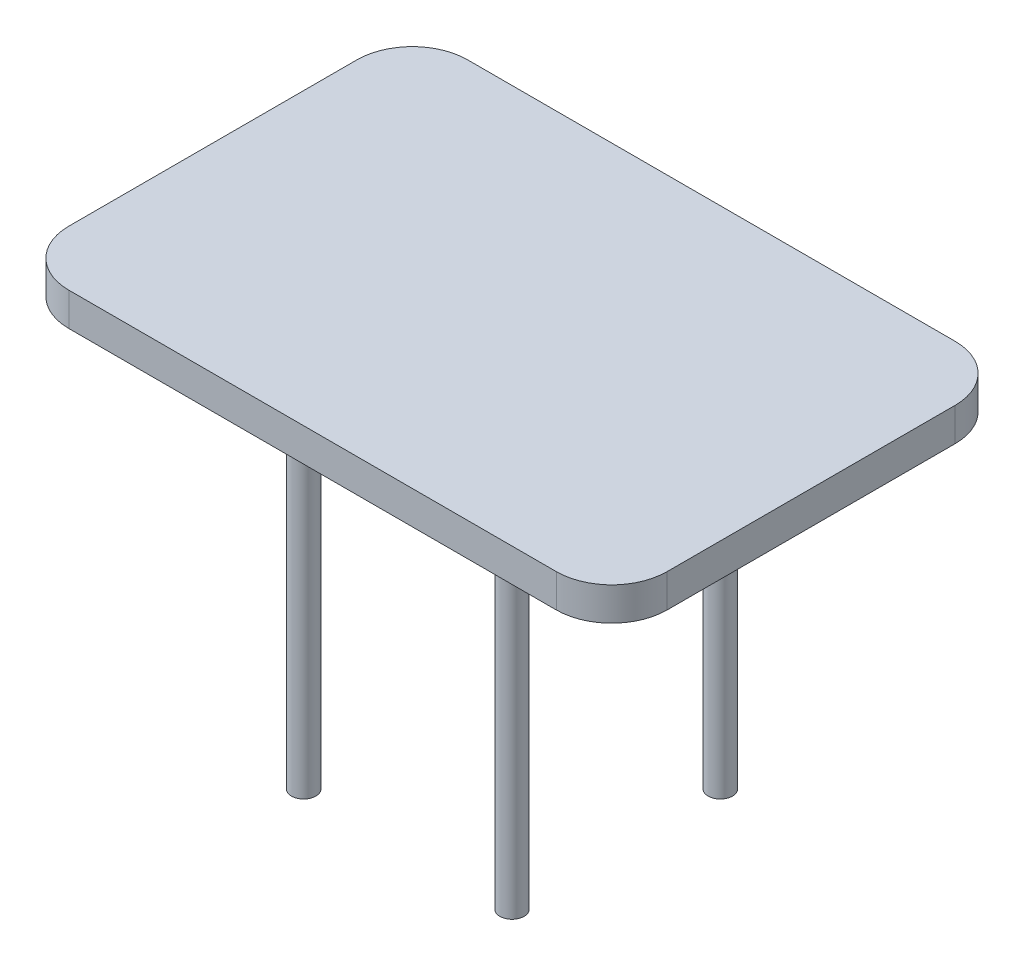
SolidWorks part; units mm, degrees
ref_plane "Front Plane" through (0, 0, 0) normal (0, 0, 1) x (1, 0, 0)
ref_plane "Top Plane" through (0, 0, 0) normal (0, 1, 0) x (1, 0, 0)
ref_plane "Right Plane" through (0, 0, 0) normal (1, 0, 0) x (0, 0, -1)
sketch "Sketch1" plane through (0, 0, 0) normal (0, 1, 0) x (1, 0, 0)
  line L1 (-75, 50) -> (75, 50) construction
  line L2 (-75, 50) -> (-75, -50) construction
  line L3 (-75, -50) -> (75, -50) construction
  line L4 (75, 50) -> (75, -50) construction
  line L5 (-75, 50) -> (75, -50) construction
  line L6 (-75, -50) -> (75, 50) construction
  line L7 (-135, 90) -> (135, 90)
  line L8 (-135, 90) -> (-135, -90)
  line L9 (-135, -90) -> (135, -90)
  line L10 (135, 90) -> (135, -90)
  line L11 (-135, 90) -> (135, -90) construction
  line L12 (-135, -90) -> (135, 90) construction
  circle A0 centre (75, 50) radius 7.5
  circle A1 centre (-75, 50) radius 7.5
  circle A2 centre (-75, -50) radius 7.5
  circle A3 centre (75, -50) radius 7.5
  point P0 (0, 0)
  point P6 (0, 0)
  dimension "D4" = 15
  dimension "D1" = 100
  dimension "D2" = 150
  dimension "D3" = 180
extrude "Extrude1" add sketch "Sketch1" against normal blind 15 contours L9 L10 L7 L8
sketch "Sketch2" plane through (0, -15, 0) normal (0, -1, 0) x (1, 0, 0)
  circle A0 centre (0, 0) radius 15
  circle A1 centre (0, 0) radius 30
  dimension "D1" = 30
  dimension "D2" = 15
extrude "Extrude3" add sketch "Sketch2" along normal blind 25
chamfer "Chamfer1" distance 10 angle 45 1 edges at (0, -15, 30)
sketch "Sketch3" plane through (0, -15, 0) normal (0, -1, 0) x (1, 0, 0)
  line L1 (-47, 47) -> (47, 47) construction
  line L2 (-47, 47) -> (-47, -47) construction
  line L3 (-47, -47) -> (47, -47) construction
  line L4 (47, 47) -> (47, -47) construction
  line L5 (-47, 47) -> (47, -47) construction
  line L6 (-47, -47) -> (47, 47) construction
  circle A0 centre (-47, 47) radius 5.5
  circle A1 centre (47, 47) radius 5.5
  circle A2 centre (47, -47) radius 5.5
  circle A3 centre (-47, -47) radius 5.5
  point P0 (0, 0)
  dimension "D2" = 11
  dimension "D1" = 94
extrude "Extrude4" add sketch "Sketch3" along normal blind 170
sketch "Sketch4" plane through (0, -15, 0) normal (0, -1, 0) x (1, 0, 0)
  circle A17 centre (-47, 47) radius 10.5
  circle A18 centre (-47, 47) radius 10.5
  circle A20 centre (-47, -47) radius 10.5
  circle A21 centre (-47, -47) radius 10.5
  circle A23 centre (47, -47) radius 10.5
  circle A24 centre (47, -47) radius 10.5
  circle A26 centre (47, 47) radius 10.5
  circle A27 centre (47, 47) radius 10.5
  dimension "D1" = 5
  dimension "D2" = 5
  dimension "D3" = 5
  dimension "D4" = 5
extrude "Extrude5" add sketch "Sketch4" along normal blind 15
chamfer "Chamfer3" distance 2 angle 45 4 edges at (47, -30, 36.5) (47, -30, -57.5) (-47, -30, -57.5) (-47, -30, 36.5)
fillet "Fillet1" radius 25 4 edges at (135, -7.5, 90) (135, -7.5, -90) (-135, -7.5, -90) (-135, -7.5, 90)
